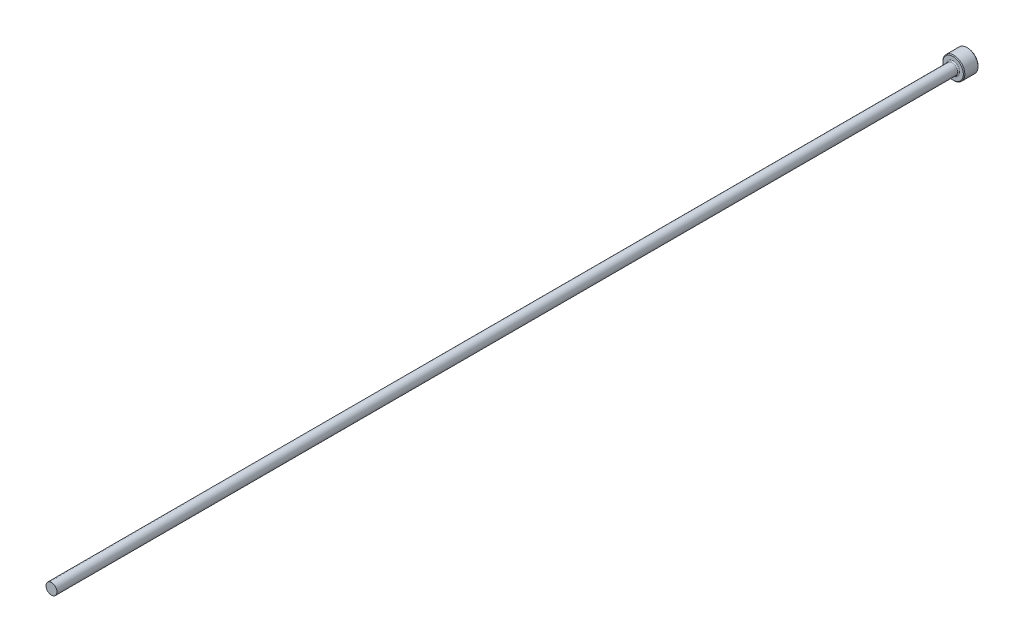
SolidWorks part; units mm, degrees
ref_plane "Front Plane" through (0, 0, 0) normal (0, 0, 1) x (1, 0, 0)
ref_plane "Top Plane" through (0, 0, 0) normal (0, 1, 0) x (1, 0, 0)
ref_plane "Right Plane" through (0, 0, 0) normal (1, 0, 0) x (0, 0, -1)
sketch "Sketch1" plane through (0, 0, 0) normal (1, 0, 0) x (0, 0, -1)
  line L0 (0, 0) -> (0, 3)
  line L1 (0, 3.3) -> (0, -3.3) construction
  line L2 (0, 3) -> (-4, 3)
  line L3 (-4, 3) -> (-4, 1.8)
  line L4 (-4.3, 1.5) -> (-250, 1.5)
  line L5 (-250, 1.5) -> (-250, 0)
  line L6 (3.3, 0) -> (-3.3, 0) construction
  line L7 (-250, 0) -> (0, 0)
  line L8 (-109.0506, 0) -> (16.9928, 0) construction
  arc A0 (-4, 1.8) -> (-4.3, 1.5) centre (-4.3, 1.8) cw
  dimension "D1" = 0.3
  dimension "D2" = 6
  dimension "D3" = 3
  dimension "D4" = 250
  dimension "D5" = 4
revolve "Revolve1" add sketch "Sketch1" angle 360 about L8
chamfer "Chamfer1" distance 0.2 angle 45 2 edges at (3, 0, 0) (3, 0, 4)
